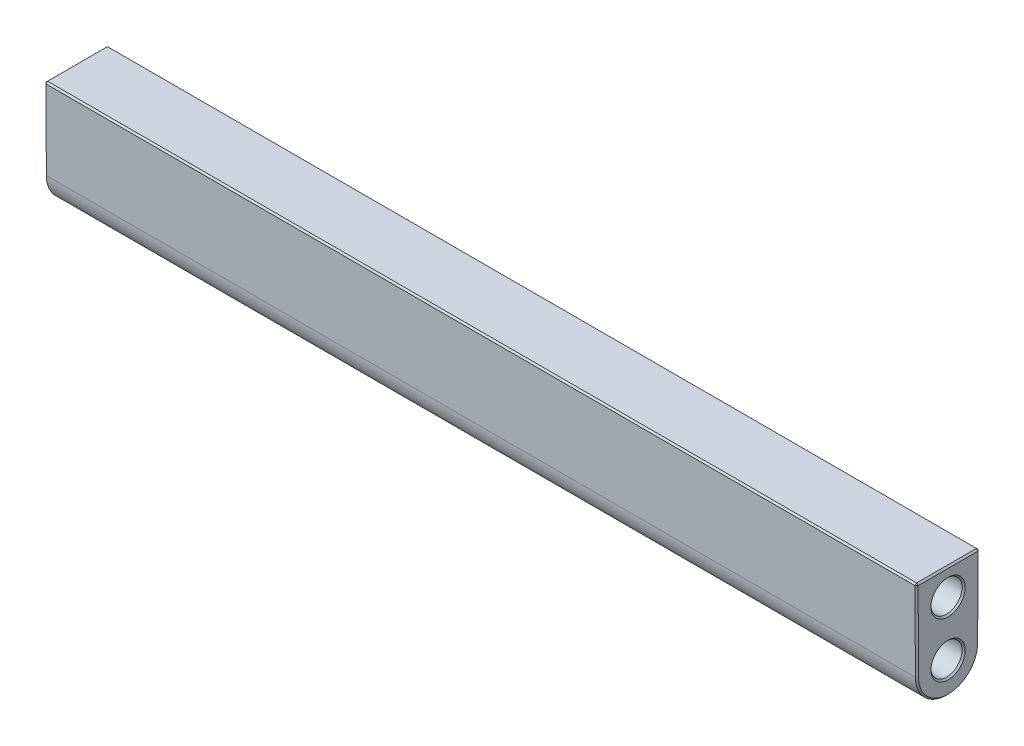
SolidWorks part; units mm, degrees
ref_plane "Спереди" through (0, 0, 0) normal (0, 0, 1) x (1, 0, 0)
ref_plane "Сверху" through (0, 0, 0) normal (0, 1, 0) x (1, 0, 0)
ref_plane "Справа" through (0, 0, 0) normal (1, 0, 0) x (0, 0, -1)
sketch "Эскиз1" plane through (0, 0, 0) normal (1, 0, 0) x (0, 0, -1)
  line L0 (-10.11, 26) -> (-9.9999, -0.0423)
  line L1 (-10.11, 26) -> (10.11, 26)
  line L2 (10.11, 26) -> (9.9999, -0.0423)
  line L3 (0, 0) -> (0, 26) construction
  arc A0 (-9.9999, -0.0423) -> (9.9999, -0.0423) centre (0, 0) ccw
  dimension "D1" = 20
  dimension "D2" = 26
  dimension "D3" = 20.22
extrude "Бобышка-Вытянуть1" add sketch "Эскиз1" along normal mid plane 280
sketch "Эскиз2" plane through (140, 0, 0) normal (1, 0, 0) x (0, 0, -1)
  circle A0 centre (0, 0) radius 5
  circle A1 centre (0, 17.5) radius 5
  dimension "D1" = 10
  dimension "D2" = 17.5
extrude "Вырез-Вытянуть1" cut sketch "Эскиз2" against normal blind 20
mirror "Зеркальное отражение1" about plane through (0, 0, 0) normal (1, 0, 0) of "Вырез-Вытянуть1"
chamfer "Фаска1" distance 0.5 angle 45 18 edges at (-140, 0, -5) (-120, 0, -5) (-140, 17.5, -5) (-120, 17.5, -5) (140, 0, -5) (120, 0, -5) (140, 17.5, -5) (120, 17.5, -5) (0, 26, -10.11) (0, 26, 10.11) (-140, 26, 0) (-140, 12.9789, 10.055) (-140, 12.9789, -10.055) (-140, -10, 0) (140, 12.9789, -10.055) (140, -10, 0) (140, 26, 0) (140, 12.9789, 10.055)
